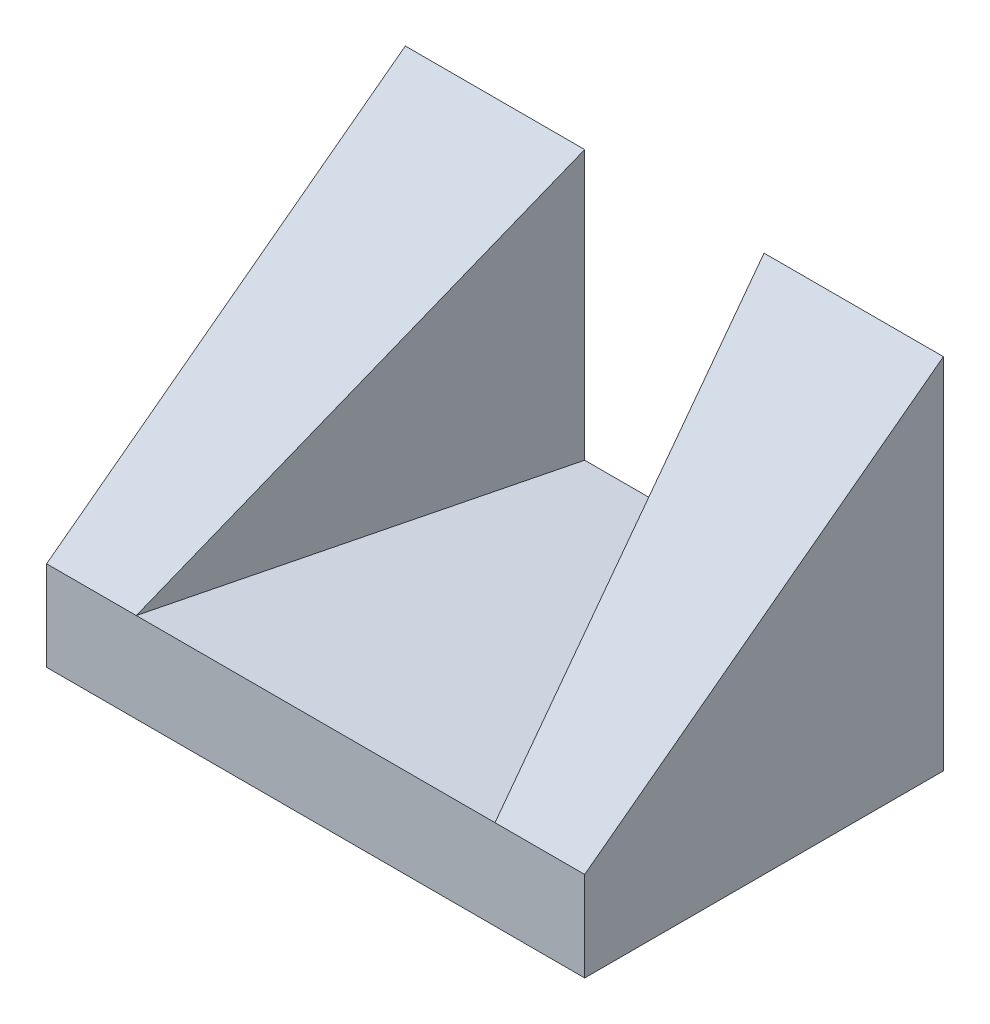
SolidWorks part; units mm, degrees
ref_plane "Front Plane" through (0, 0, 0) normal (0, 0, 1) x (1, 0, 0)
ref_plane "Top Plane" through (0, 0, 0) normal (0, 1, 0) x (1, 0, 0)
ref_plane "Right Plane" through (0, 0, 0) normal (1, 0, 0) x (0, 0, -1)
sketch "Sketch1" plane through (0, 0, 0) normal (1, 0, 0) x (0, 0, -1)
  line L0 (0, -40) -> (0, 0)
  line L1 (0, 0) -> (-40, -30)
  line L2 (-40, -30) -> (-40, -40)
  line L3 (-40, -40) -> (0, -40)
  dimension "D1" = 10
  dimension "D2" = 40
  dimension "D3" = 40
extrude "Extrude1" add sketch "Sketch1" along normal mid plane 60
sketch "Sketch2" plane through (0, 0, 0) normal (0, 1, 0) x (1, 0, 0)
  line L0 (10, 0) -> (20, -40)
  line L1 (30, 0) -> (-30, 0) construction
  line L2 (30, -40) -> (-30, -40) construction
  line L3 (0, 0) -> (0, -49.6724) construction
  line L4 (-10, 0) -> (-20, -40)
  line L5 (-10, 0) -> (10, 0)
  line L7 (20, -40) -> (-20, -40)
  dimension "D1" = 40
  dimension "D2" = 20
extrude "Extrude2" cut sketch "Sketch2" against normal blind 30
